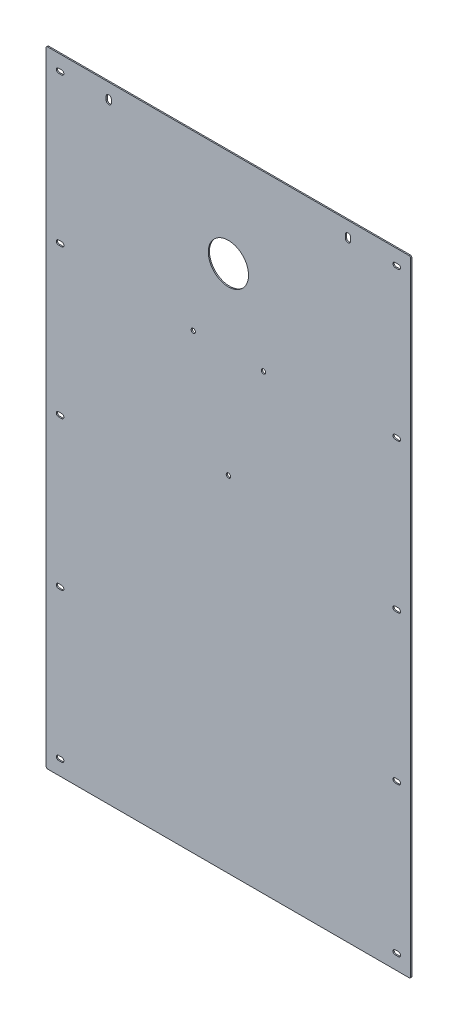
SolidWorks part; units mm, degrees
ref_plane "Ebene vorne" through (0, 0, 0) normal (0, 0, 1) x (1, 0, 0)
ref_plane "Ebene oben" through (0, 0, 0) normal (0, 1, 0) x (1, 0, 0)
ref_plane "Ebene rechts" through (0, 0, 0) normal (1, 0, 0) x (0, 0, -1)
sketch "Skizze1" plane through (0, 0, 0) normal (0, 0, 1) x (1, 0, 0)
  line L1 (-228.5, -392) -> (228.5, -392)
  line L2 (-228.5, -392) -> (-228.5, 392)
  line L3 (-228.5, 392) -> (228.5, 392)
  line L4 (228.5, -392) -> (228.5, 392)
  line L5 (-228.5, -392) -> (228.5, 392) construction
  line L6 (-228.5, 392) -> (228.5, -392) construction
  point P0 (0, 0)
  dimension "D1" = 457
  dimension "D2" = 784
extrude "Aufsatz-Linear austragen1" add sketch "Skizze1" along normal blind 1.5
sketch "Skizze2" plane through (0, 0, 1.5) normal (0, 0, 1) x (1, 0, 0)
  line L0 (228.5, 392) -> (-228.5, 392) construction
  line L1 (-89, 10) -> (89, 10)
  line L2 (-94, 15) -> (-94, 323)
  line L3 (-89, 328) -> (89, 328)
  line L4 (94, 15) -> (94, 323)
  line L5 (-94, 10) -> (94, 328) construction
  line L6 (-94, 328) -> (94, 10) construction
  arc A0 (94, 15) -> (89, 10) centre (89, 15) cw
  arc A1 (-94, 15) -> (-89, 10) centre (-89, 15) ccw
  arc A2 (94, 323) -> (89, 328) centre (89, 323) ccw
  arc A3 (-89, 328) -> (-94, 323) centre (-89, 323) ccw
  point P0 (0, 169)
  dimension "D3" = 5
  dimension "D1" = 188
  dimension "D2" = 64
  dimension "D4" = 10
extrude "Schnitt-Linear austragen1" [suppressed] cut sketch "Skizze2" against normal through all
hole_wizard "Durchgangsloch für M51" positions "Skizze3" profile "Skizze4" hole size "M5" standard "DIN"
sketch "Skizze3" plane through (0, 0, 1.5) normal (0, 0, 1) x (1, 0, 0)
  line L0 (-211, 373) -> (-211, 0) construction
  line L1 (-211, 0) -> (-211, -373) construction
  line L2 (-211, -373) -> (211, -373) construction
  line L3 (211, -373) -> (211, 0) construction
  line L4 (211, 0) -> (211, 373) construction
  line L5 (211, 373) -> (-211, 373) construction
  line L7 (0, 0) -> (0, 373) construction
  line L9 (228.5, 392) -> (-228.5, 392) construction
  line L10 (228.5, -392) -> (228.5, 392) construction
  line L11 (-228.5, -392) -> (228.5, -392) construction
  point P1 (-211, 373)
  point P2 (-211, 0)
  point P4 (-211, -373)
  point P6 (211, -373)
  point P8 (211, 0)
  point P10 (211, 373)
  point P30 (211, 186.5)
  point P32 (211, -186.5)
  point P34 (-211, -186.5)
  point P36 (-211, 186.5)
  dimension "D1" = 19
  dimension "D2" = 17.5
  dimension "D3" = 19
sketch "Skizze4" plane through (-211, 373, 1.5) normal (1, 0, 0) x (0, -1, 0)
  line L0 (0, 0) -> (0, 1.5)
  line L1 (0, 1.5) -> (2.75, 1.5)
  line L2 (2.75, 1.5) -> (2.75, 0)
  line L5 (2.75, 0) -> (0, 0)
  line L11 (0, -6.35) -> (0, 107.95) construction
  dimension "Bohrerdurchmesser" = 5.5
  dimension "Bohrungstiefe" = 1.5
sketch "Skizze6" plane through (0, 0, 1.5) normal (0, 0, 1) x (1, 0, 0)
  line L0 (0, 0) -> (0, 452.7519) construction
  line L1 (213, 373) -> (209, 373) construction
  line L2 (213, 370.25) -> (209, 370.25)
  line L3 (213, 375.75) -> (209, 375.75)
  line L4 (213, 186.5) -> (209, 186.5) construction
  line L5 (213, 183.75) -> (209, 183.75)
  line L6 (213, 189.25) -> (209, 189.25)
  line L7 (213, 0) -> (209, 0) construction
  line L8 (213, -2.75) -> (209, -2.75)
  line L9 (213, 2.75) -> (209, 2.75)
  line L10 (213, -186.5) -> (209, -186.5) construction
  line L11 (213, -189.25) -> (209, -189.25)
  line L12 (213, -183.75) -> (209, -183.75)
  line L13 (213, -373) -> (209, -373) construction
  line L14 (213, -375.75) -> (209, -375.75)
  line L15 (213, -370.25) -> (209, -370.25)
  line L16 (-213, 373) -> (-209, 373) construction
  line L17 (-213, 370.25) -> (-209, 370.25)
  line L18 (-213, 375.75) -> (-209, 375.75)
  line L19 (-213, 186.5) -> (-209, 186.5) construction
  line L20 (-213, 183.75) -> (-209, 183.75)
  line L21 (-213, 189.25) -> (-209, 189.25)
  line L22 (-213, 0) -> (-209, 0) construction
  line L23 (-213, -2.75) -> (-209, -2.75)
  line L24 (-213, 2.75) -> (-209, 2.75)
  line L25 (-213, -186.5) -> (-209, -186.5) construction
  line L26 (-213, -189.25) -> (-209, -189.25)
  line L27 (-213, -183.75) -> (-209, -183.75)
  line L28 (-213, -373) -> (-209, -373) construction
  line L29 (-213, -375.75) -> (-209, -375.75)
  line L30 (-213, -370.25) -> (-209, -370.25)
  arc A3 (213, 370.25) -> (213, 375.75) centre (213, 373) ccw
  arc A4 (209, 375.75) -> (209, 370.25) centre (209, 373) ccw
  circle A5 centre (211, 373) radius 2.75 construction
  arc A6 (213, 183.75) -> (213, 189.25) centre (213, 186.5) ccw
  arc A7 (209, 189.25) -> (209, 183.75) centre (209, 186.5) ccw
  arc A8 (213, -2.75) -> (213, 2.75) centre (213, 0) ccw
  arc A9 (209, 2.75) -> (209, -2.75) centre (209, 0) ccw
  arc A10 (213, -189.25) -> (213, -183.75) centre (213, -186.5) ccw
  arc A11 (209, -183.75) -> (209, -189.25) centre (209, -186.5) ccw
  arc A12 (213, -375.75) -> (213, -370.25) centre (213, -373) ccw
  arc A13 (209, -370.25) -> (209, -375.75) centre (209, -373) ccw
  arc A14 (-213, 370.25) -> (-213, 375.75) centre (-213, 373) cw
  arc A15 (-209, 375.75) -> (-209, 370.25) centre (-209, 373) cw
  arc A16 (-213, 183.75) -> (-213, 189.25) centre (-213, 186.5) cw
  arc A17 (-209, 189.25) -> (-209, 183.75) centre (-209, 186.5) cw
  arc A18 (-213, -2.75) -> (-213, 2.75) centre (-213, 0) cw
  arc A19 (-209, 2.75) -> (-209, -2.75) centre (-209, 0) cw
  arc A20 (-213, -189.25) -> (-213, -183.75) centre (-213, -186.5) cw
  arc A21 (-209, -183.75) -> (-209, -189.25) centre (-209, -186.5) cw
  arc A22 (-213, -375.75) -> (-213, -370.25) centre (-213, -373) cw
  arc A23 (-209, -370.25) -> (-209, -375.75) centre (-209, -373) cw
  point P4 (211, 373)
  point P13 (211, 186.5)
  point P19 (211, 0)
  point P26 (211, -186.5)
  point P34 (211, -373)
  point P42 (-211, 373)
  point P49 (-211, 186.5)
  point P56 (-211, 0)
  point P69 (-211, -186.5)
  point P76 (-211, -373)
  dimension "D1" = 4
extrude "Schnitt-Linear austragen3" cut sketch "Skizze6" against normal through all
fillet "Verrundung2" radius 2
sketch "Skizze7" plane through (0, 0, 1.5) normal (0, 0, 1) x (1, 0, 0)
  circle A0 centre (0, 270) radius 25.25
  dimension "D1" = 50.5
  dimension "D2" = 270
extrude "Schnitt-Linear austragen4" cut sketch "Skizze7" against normal through all
hole_wizard "Durchgangsloch für M61" positions "Skizze10" profile "Skizze11" hole size "M6" standard "DIN"
sketch "Skizze10" plane through (0, 0, 1.5) normal (0, 0, 1) x (1, 0, 0)
  line L0 (0, 0) -> (0, 527.3929) construction
  line L2 (226.5, 392) -> (-226.5, 392) construction
  point P0 (-150, 373)
  point P2 (150, 373)
  dimension "D1" = 19
  dimension "D2" = 300
sketch "Skizze11" plane through (-150, 373, 1.5) normal (1, 0, 0) x (0, -1, 0)
  line L0 (0, 0) -> (0, 1.5)
  line L1 (0, 1.5) -> (3.3, 1.5)
  line L2 (3.3, 1.5) -> (3.3, 0)
  line L5 (3.3, 0) -> (0, 0)
  line L11 (0, -6.35) -> (0, 107.95) construction
  dimension "Bohrerdurchmesser" = 6.6
  dimension "Bohrungstiefe" = 1.5
sketch "Skizze12" plane through (0, 0, 1.5) normal (0, 0, 1) x (1, 0, 0)
  line L0 (-150, 371) -> (-150, 375) construction
  line L1 (-153.3, 371) -> (-153.3, 375)
  line L2 (-146.7, 371) -> (-146.7, 375)
  line L3 (150, 371) -> (150, 375) construction
  line L4 (146.7, 371) -> (146.7, 375)
  line L5 (153.3, 371) -> (153.3, 375)
  arc A0 (-153.3, 371) -> (-146.7, 371) centre (-150, 371) ccw
  arc A1 (-146.7, 375) -> (-153.3, 375) centre (-150, 375) ccw
  arc A2 (146.7, 371) -> (153.3, 371) centre (150, 371) ccw
  arc A3 (153.3, 375) -> (146.7, 375) centre (150, 375) ccw
  circle A4 centre (150, 373) radius 3.3 construction
  point P2 (-150, 373)
  point P9 (150, 373)
  dimension "D1" = 4
extrude "Schnitt-Linear austragen5" cut sketch "Skizze12" against normal through all
sketch "Skizze13" [suppressed] plane through (0, 0, 1.5) normal (0, 0, 1) x (1, 0, 0)
  line L0 (-226.5, -392) -> (226.5, -392) construction
  circle A0 centre (0, -242) radius 6.7
  dimension "D1" = 13.4
  dimension "D2" = 150
extrude "Schnitt-Linear austragen6" [suppressed] cut sketch "Skizze13" against normal blind 10
hole_wizard "Durchgangsloch für M52" positions "Skizze14" profile "Skizze15" hole size "M5" standard "DIN"
sketch "Skizze14" plane through (0, 0, 1.5) normal (0, 0, 1) x (1, 0, 0)
  line L0 (0, 40) -> (110, 175) construction
  line L1 (110, 175) -> (-110, 175) construction
  line L2 (-110, 175) -> (0, 40) construction
  line L4 (0, 40) -> (0, -118.679) construction
  point P0 (0, 40)
  point P20 (-44, 175)
  point P22 (44, 175)
  dimension "D1" = 220
  dimension "D2" = 135
  dimension "D3" = 40
  dimension "D4" = 88
sketch "Skizze15" plane through (0, 40, 1.5) normal (1, 0, 0) x (0, -1, 0)
  line L0 (0, 0) -> (0, 1.5)
  line L1 (0, 1.5) -> (2.75, 1.5)
  line L2 (2.75, 1.5) -> (2.75, 0)
  line L5 (2.75, 0) -> (0, 0)
  line L11 (0, -6.35) -> (0, 107.95) construction
  dimension "Bohrerdurchmesser" = 5.5
  dimension "Bohrungstiefe" = 1.5
